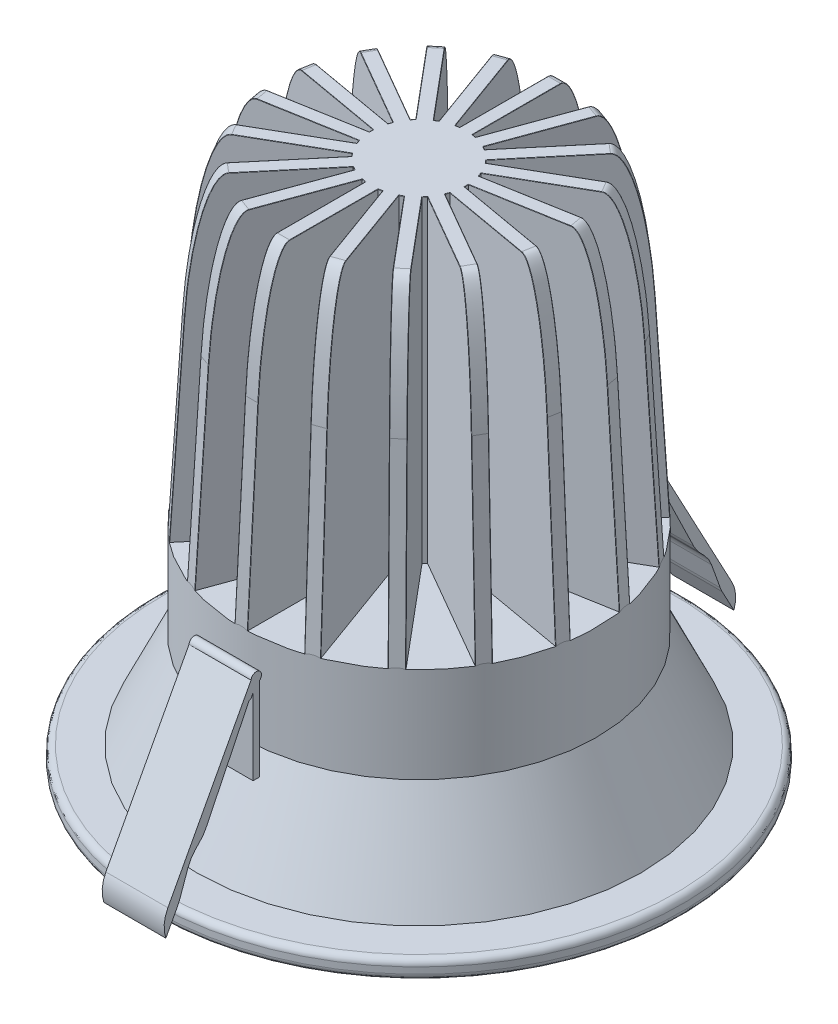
SolidWorks part; units mm, degrees
ref_plane "Alzado" through (0, 0, 0) normal (0, 0, 1) x (1, 0, 0)
ref_plane "Planta" through (0, 0, 0) normal (0, 1, 0) x (1, 0, 0)
ref_plane "Vista lateral" through (0, 0, 0) normal (1, 0, 0) x (0, 0, -1)
sketch "Croquis1" plane through (0, 0, 0) normal (0, 1, 0) x (1, 0, 0)
  circle A0 centre (0, 0) radius 41.5
  dimension "D1" = 83
extrude "Saliente-Extruir1" add sketch "Croquis1" along normal blind 3
sketch "Croquis2" plane through (0, 3, 0) normal (0, 1, 0) x (1, 0, 0)
  circle A0 centre (0, 0) radius 35
  dimension "D1" = 70
extrude "Saliente-Extruir2" add sketch "Croquis2" along normal blind 15 draft 25
sketch "Croquis3" plane through (0, 18, 0) normal (0, 1, 0) x (1, 0, 0)
  circle A0 centre (0, 0) radius 28.0054
extrude "Saliente-Extruir3" add sketch "Croquis3" along normal blind 15
sketch "Croquis4" plane through (0, 33, 0) normal (0, 1, 0) x (1, 0, 0)
  circle A0 centre (0, 0) radius 25
  dimension "D1" = 50
extrude "Saliente-Extruir5" add sketch "Croquis4" along normal blind 50 draft 5
sketch "Croquis7" plane through (0, 83, 0) normal (0, 1, 0) x (1, 0, 0)
  circle A10 centre (0, 0) radius 7.5
  circle A11 centre (0, 0) radius 25 construction
  circle A12 centre (0, 0) radius 25
extrude "Cortar-Extruir3" cut sketch "Croquis7" against normal blind 50
sketch "Croquis8" plane through (0, 83, 0) normal (0, 1, 0) x (1, 0, 0)
  line L1 (-1, 7.433) -> (-1, 27.9875)
  line L3 (1, 7.433) -> (1, 27.9875)
  circle A0 centre (0, 0) radius 28.0054 construction
  circle A1 centre (0, 0) radius 7.5 construction
  circle A2 centre (0, 0) radius 28.0054
  arc A3 (1, 27.9875) -> (-1, 27.9875) centre (0, 0) ccw
  arc A4 (1, 7.433) -> (-1, 7.433) centre (0, 0) ccw
  dimension "D2" = 0
extrude "Saliente-Extruir6" add sketch "Croquis8" against normal blind 50
sketch "Croquis9" plane through (1, 0, 0) normal (1, 0, 0) x (0, 0, -1)
  line L0 (27.9875, 33) -> (25.2574, 83)
  line L1 (7.433, 83) -> (27.9875, 83) construction
  line L4 (25.2574, 83) -> (32.5045, 83.3957)
  line L5 (32.5045, 83.3957) -> (27.9875, 33)
extrude "Cortar-Extruir5" cut sketch "Croquis9" against normal blind 50
fillet "Redondeo6" radius 5 1 edges at (0, 83, -25.2574)
pattern_circular "MatrizC7" count 18 over 360 about axis through (0, 33, 0) along (0, 1, 0) of "Saliente-Extruir6", "Redondeo6", "Cortar-Extruir5"
fillet "Redondeo7" radius 0.05 162 edges at (-7.5, 83, 0) (-7.0477, 83, 2.5652) (-5.7453, 83, 4.8209) (-3.75, 83, 6.4952) (-1.3024, 83, 7.3861) (1.3024, 83, 7.3861) (3.75, 83, 6.4952) (5.7453, 83, 4.8209) (7.0477, 83, 2.5652) (7.5, 83, 0) (7.0477, 83, -2.5652) (5.7453, 83, -4.8209) (-1.3024, 83, -7.3861) (3.75, 83, -6.4952) (1.3024, 83, -7.3861) (-3.75, 83, -6.4952) (-5.7453, 83, -4.8209) (-7.0477, 83, -2.5652)
sketch "Croquis10" plane through (0, 0, 0) normal (0, -1, 0) x (1, 0, 0)
  circle A0 centre (0, 0) radius 34
  dimension "D1" = 68
extrude "Cortar-Extruir6" cut sketch "Croquis10" against normal blind 20 draft 23
fillet "Redondeo8" radius 3 1 edges at (0, 0, -34)
fillet "Redondeo9" radius 1 3 edges at (0, 20, -25.5105) (0, 3, 41.5) (0, 0, 41.5)
ref_plane "Plano1" through (0, 0, 40) normal (0, 0, 1) x (1, 0, 0)
sketch "Croquis11" plane through (0, 0, 40) normal (0, 0, 1) x (1, 0, 0)
  line L1 (0, 0) -> (0, 25.5) construction
  circle A0 centre (0, 25.5) radius 2
  dimension "D2" = 4
  dimension "D1" = 25.5
ref_plane "Plano2" through (0, 0, 30) normal (0, 0, 1) x (1, 0, 0)
sketch "Croquis13" plane through (0, 0, 30) normal (0, 0, 1) x (1, 0, 0)
  circle A0 centre (0, 25.5) radius 2 construction
  circle A1 centre (0, 25.5) radius 2
extrude "Saliente-Extruir8" add sketch "Croquis13" against normal up to next
sketch "Croquis14" plane through (0, 0, 30) normal (0, 0, 1) x (1, 0, 0)
  line L2 (-4.8821, 29.8251) -> (-4.8821, 16.0055)
  line L3 (-4.8821, 16.0055) -> (4.8821, 16.0055)
  line L4 (4.8821, 29.8251) -> (4.8821, 16.0055)
  line L5 (-2.224, 29.8251) -> (4.8821, 16.0055) construction
  line L6 (-4.8821, 16.0055) -> (2.224, 29.8251) construction
  line L7 (4.8821, 29.8251) -> (-4.8821, 29.8251)
  point P0 (0, 25.5)
extrude "Saliente-Extruir9" add sketch "Croquis14" along normal blind 1
sketch "Croquis15" plane through (4.8821, 0, 0) normal (1, 0, 0) x (0, 0, -1)
  line L0 (-31, 29.8251) -> (-30, 29.8251) construction
  circle A0 centre (-30.5, 29.8251) radius 0.8274
extrude "Saliente-Extruir10" add sketch "Croquis15" against normal up to surface (9.7642 mm away)
sketch "Croquis16" plane through (4.8821, 0, 0) normal (1, 0, 0) x (0, 0, -1)
  line L0 (-31.3248, 29.8907) -> (-46.1573, 2.1562)
  line L1 (-46.1573, 2.1562) -> (-44.7383, 1.3973)
  line L2 (-44.7383, 1.3973) -> (-42.7099, 5.1901)
  line L3 (-42.7099, 5.1901) -> (-40.871, 10.3346)
  line L4 (-40.871, 10.3346) -> (-38.7411, 12.6113)
  line L5 (-38.7411, 12.6113) -> (-31.6371, 27.2383)
  line L6 (-31.6371, 27.2383) -> (-31.3248, 27.3738)
  line L7 (-31.3248, 27.3738) -> (-31, 28.0426)
  line L8 (-31, 16.0055) -> (-31, 29.1658) construction
  line L9 (-31, 28.0426) -> (-31, 29.1658)
  arc A0 (-30, 29.1658) -> (-31, 29.1658) centre (-30.5, 29.8251) ccw construction
  arc A1 (-31.3248, 29.8907) -> (-31, 29.1658) centre (-30.5, 29.8251) ccw
extrude "Saliente-Extruir11" add sketch "Croquis16" against normal up to surface (9.7642 mm away)
fillet "Redondeo10" radius 5 4 edges at (0, 2.1562, 46.1573) (0, 5.1901, 42.7099) (0, 10.3346, 40.871) (0, 12.6113, 38.7411)
mirror "Simetría1" about plane through (0, 0, 0) normal (0, 0, 1) of "Redondeo10", "Saliente-Extruir11", "Saliente-Extruir10", "Saliente-Extruir9", "Saliente-Extruir8"
